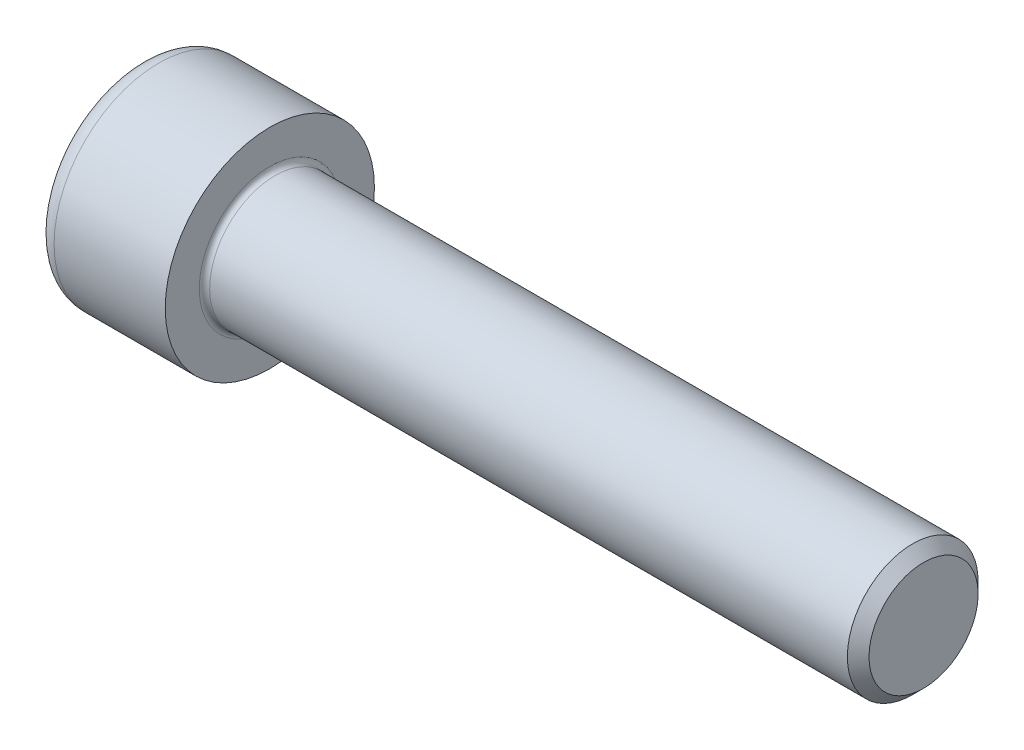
SolidWorks part; units mm, degrees
ref_plane "Plane1" through (0, 0, 0) normal (0, 0, 1) x (1, 0, 0)
ref_plane "Plane2" through (0, 0, 0) normal (0, 1, 0) x (1, 0, 0)
ref_plane "Plane3" through (0, 0, 0) normal (1, 0, 0) x (0, 0, -1)
sketch "BodySke" plane through (0, 0, 0) normal (0, 0, 1) x (1, 0, 0)
  line L0 (0, 0) -> (0, 8)
  line L1 (0, 8) -> (10, 8)
  line L2 (10, 8) -> (10, 5)
  line L3 (10, 5) -> (59.172, 5)
  line L4 (60, 4.172) -> (60, 0)
  line L5 (60, 0) -> (0, 0)
  line L6 (-31.75, 0) -> (127, 0) construction
  line L8 (60, 4.172) -> (59.172, 5)
  line L10 (60, -4.172) -> (59.172, -5) construction
  line L11 (11.5, 9.525) -> (11.5, 3.175) construction
  line L12 (28, 9.525) -> (28, 3.175) construction
  line L13 (0, 9.525) -> (0, 3.175) construction
  dimension "Diameter" = 10
  dimension "Head_ht" = 10
  dimension "Length" = 50
  dimension "Body_ch_ang" = 45
  dimension "Head_dia" = 16
  dimension "Minor_dia" = 8.344
  dimension "Advance" = 1.5
  dimension "Thread_nom" = 32
  dimension "Thread_length" = 60
revolve "Base-Revolve" add sketch "BodySke"
fillet "Fillet1" radius 0.4 1 edges at (10, 0, 5)
fillet "Fillet2" radius 1.5 1 edges at (0, 0, 8)
sketch "Sketch2" plane through (0, 0, 0) normal (0, 0, 1) x (1, 0, 0)
  line L0 (0, 4.0575) -> (5, 4.0575)
  line L1 (5, 4.0575) -> (7.3426, 0)
  line L2 (-31.75, 0) -> (127, 0) construction
  line L3 (7.3426, 0) -> (0, 0)
  line L4 (0, 0) -> (0, 4.0575)
  line L6 (0, 0) -> (47.625, 0) construction
  dimension "D1" = 4.0575
  dimension "D2" = 60
  dimension "Depth" = 5
revolve "Hex-PreBroach" cut sketch "Sketch2" angle 360 about L6
sketch "Sketch3" plane through (0, 0, 0) normal (-1, 0, 0) x (0, 0.5, 0.866)
  line L0 (2.3426, 4.0575) -> (-2.3426, 4.0575)
  line L1 (-2.3426, 4.0575) -> (-4.6852, 0)
  line L2 (2.3426, 4.0575) -> (4.6852, 0)
  line L3 (2.3426, -4.0575) -> (4.6852, 0)
  line L4 (2.3426, -4.0575) -> (-2.3426, -4.0575)
  line L5 (-2.3426, -4.0575) -> (-4.6852, 0)
  dimension "D1" = 4.0575
  dimension "D2" = 4.0575
  dimension "Hex_size" = 8.115
extrude "Hex" cut sketch "Sketch3" against normal blind 5
sketch "ThdSchSke" plane through (0, 0, 0) normal (0, 0, 1) x (1, 0, 0)
  line L0 (28, -4.172) -> (27.4202, -5)
  line L1 (28, -4.172) -> (28.5798, -5)
  line L2 (28.5798, -5) -> (28.5798, -6.25)
  line L3 (-3.175, 0) -> (5.1513, 0) construction
  line L4 (0, 6.5) -> (0, -6.5) construction
  line L5 (28.5798, -6.25) -> (27.4202, -6.25)
  line L6 (27.4202, -6.25) -> (27.4202, -5)
  dimension "Thread_minor" = 8.344
  dimension "Diameter" = 10
  dimension "Start" = 28
  dimension "SideAngle" = 55
  dimension "VeeAngle" = 70
  dimension "Overcut" = 12.5
revolve "ThreadSchematic" [suppressed] cut sketch "ThdSchSke" angle 360 about L3
pattern_linear "ThdSchPat" [suppressed]
equation "\"D2@Sketch3\" = \"Hex_size@Sketch3\" / 2"
equation "\"D1@Sketch3\" = \"Hex_size@Sketch3\" / 2"
equation "\"D1@Sketch2\" = \"Hex_size@Sketch3\" / 2"
equation "\"Thread_minor@ThreadCosmetic\"  =  \"Minor_dia@BodySke\""
equation "\"Depth@Sketch2\" =  \"Key_eng@Hex\""
equation "\"Thread_length@ThreadCosmetic\" = ((sgn( (\"Length@BodySke\" - \"Advance@BodySke\" * 3.0) - \"Thread_nom@BodySke\" )-1)*( (\"Length@BodySke\" - \"Advance@BodySke\" * 3.0) - \"Thread_nom@BodySke\" ))/-2+ \"Thread_no"
equation "\"Thread_minor@ThdSchSke\" = \"Minor_dia@BodySke\""
equation "\"Diameter@ThdSchSke\" = \"Diameter@BodySke\""
equation "\"Overcut@ThdSchSke\" = \"Diameter@BodySke\" * 1.25"
equation "\"Start@ThdSchSke\" = \"Head_ht@BodySke\" + \"Length@BodySke\" - \"Thread_length@ThreadCosmetic\"  '---Non-countersunk---"
equation "\"Num_threads@ThdSchPat\" = int( \"Thread_length@ThreadCosmetic\" / \"Advance@BodySke\" + 0.999 )  + 1"
equation "\"Advance@ThdSchPat\" = \"Thread_length@ThreadCosmetic\" /  (\"Num_threads@ThdSchPat\" - 1) 'relax it"
equation "\"Num_threads@ThdSchPat\" = \"Num_threads@ThdSchPat\" - sgn( \"Num_threads@ThdSchPat\" - 1) '---chamfered tips only---"
